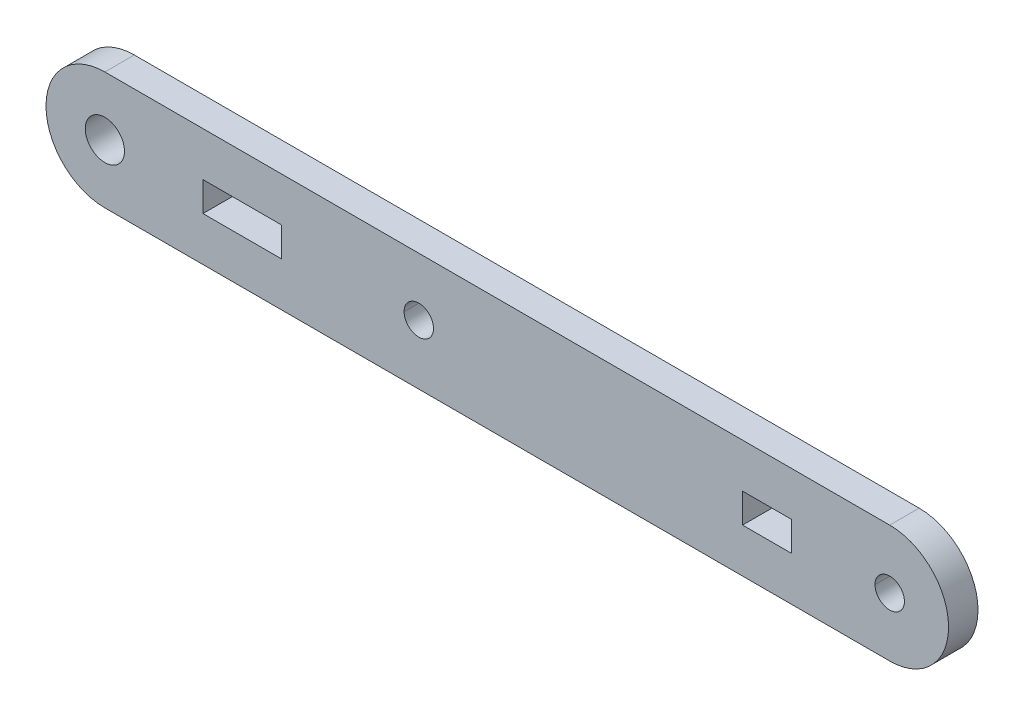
SolidWorks part; units mm, degrees
ref_plane "Front Plane" through (0, 0, 0) normal (0, 0, 1) x (1, 0, 0)
ref_plane "Top Plane" through (0, 0, 0) normal (0, 1, 0) x (1, 0, 0)
ref_plane "Right Plane" through (0, 0, 0) normal (1, 0, 0) x (0, 0, -1)
imported_body "Imported1"
sketch "Sketch1" plane through (0, 0, 3) normal (0, 0, 1) x (1, 0, 0)
  circle A0 centre (-62.9738, -40.5517) radius 2
extrude "Cut-Extrude1" cut sketch "Sketch1" against normal blind 3
